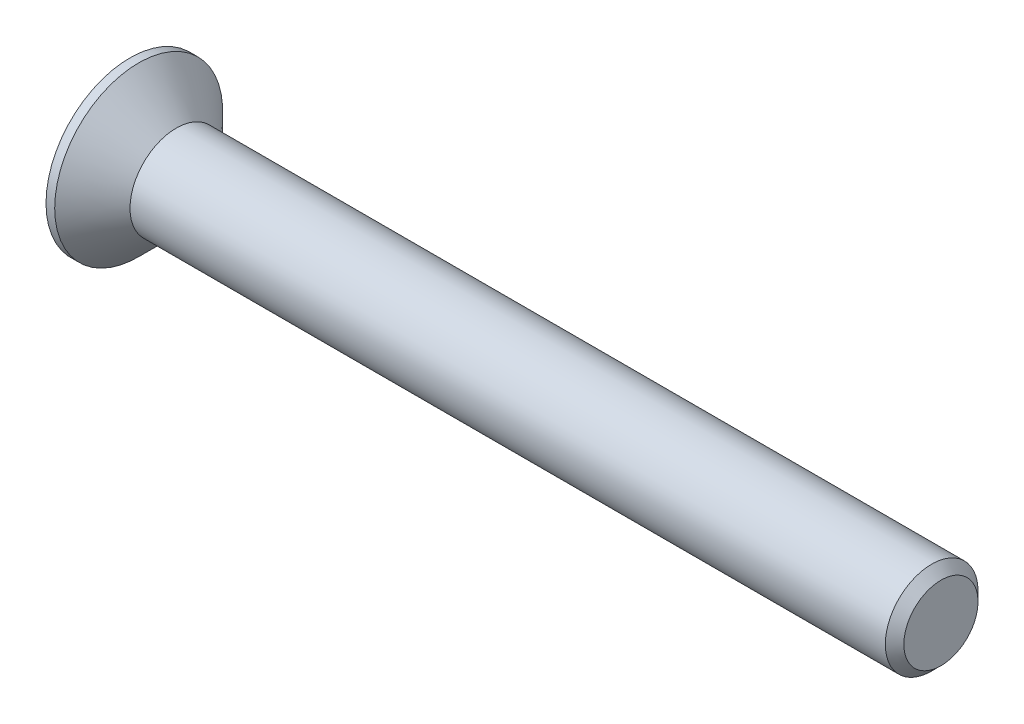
SolidWorks part; units mm, degrees
ref_plane "Front Plane" through (0, 0, 0) normal (0, 0, 1) x (1, 0, 0)
ref_plane "Top Plane" through (0, 0, 0) normal (0, 1, 0) x (1, 0, 0)
ref_plane "Right Plane" through (0, 0, 0) normal (1, 0, 0) x (0, 0, -1)
sketch "Sketch1" plane through (0, 0, 0) normal (0, 0, 1) x (1, 0, 0)
  line L1 (-4, 7.25) -> (-4, 0)
  line L2 (-4, 0) -> (66, 0)
  line L3 (66, 0) -> (66, 4)
  line L4 (66, 4) -> (0, 4)
  line L5 (-4, 7.25) -> (-3.25, 7.25)
  line L6 (-3.25, 7.25) -> (0, 4)
  dimension "D1" = 4
  dimension "D2" = 45
  dimension "D3" = 4
  dimension "D4" = 70
  dimension "D5" = 7.25
revolve "Revolve1" add sketch "Sketch1" angle 360 about L2
chamfer "Chamfer1" distance 0.8 angle 45 1 edges at (66, 0, 4)
sketch "Sketch2" plane through (-4, 0, 0) normal (-1, 0, 0) x (0, 0, 1)
  line L0 (-1.09, 4.35) -> (1.09, 4.35)
  line L1 (1.09, 4.35) -> (1.09, 1.09)
  line L2 (1.09, 1.09) -> (4.35, 1.09)
  line L3 (4.35, 1.09) -> (4.35, -1.09)
  line L4 (4.35, -1.09) -> (1.09, -1.09)
  line L5 (1.09, -1.09) -> (1.09, -4.35)
  line L6 (1.09, -4.35) -> (-1.09, -4.35)
  line L7 (-1.09, -4.35) -> (-1.09, -1.09)
  line L8 (-1.09, -1.09) -> (-4.35, -1.09)
  line L9 (-4.35, -1.09) -> (-4.35, 1.09)
  line L10 (-4.35, 1.09) -> (-1.09, 1.09)
  line L11 (-1.09, 1.09) -> (-1.09, 4.35)
  point P2 (0, 4.35)
  point P14 (0, -4.35)
  point P15 (4.35, 0)
  point P16 (-4.35, 0)
  dimension "D1" = 8.7
  dimension "D2" = 2.18
extrude "Cut-Extrude1" cut sketch "Sketch2" against normal blind 3.45
